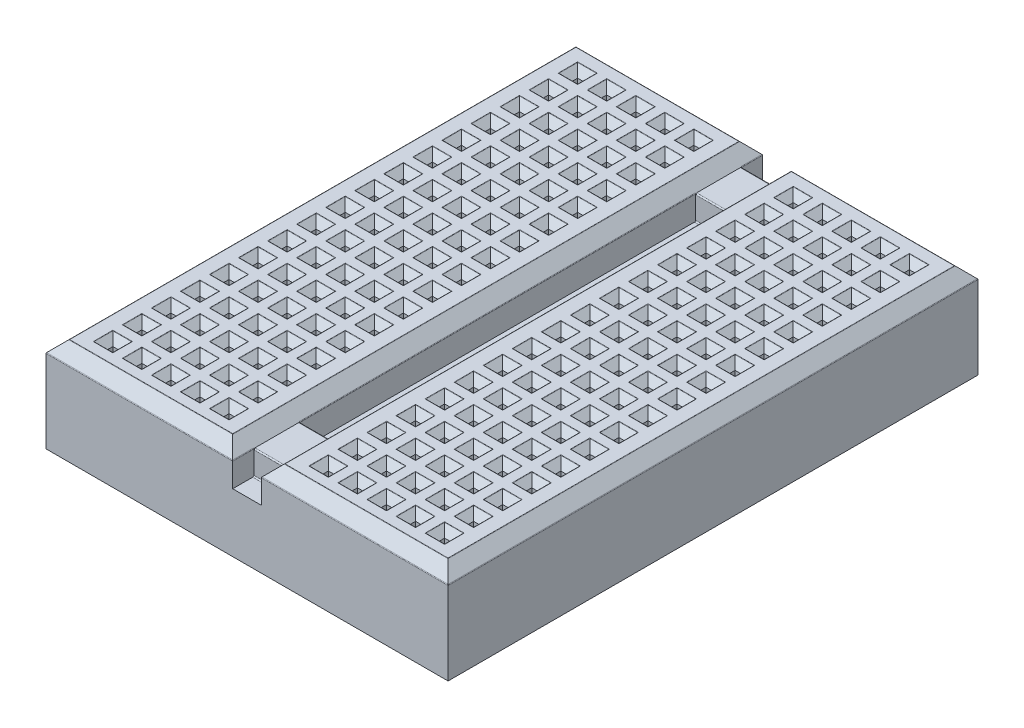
SolidWorks part; units mm, degrees
ref_plane "Front Plane" through (0, 0, 0) normal (0, 0, 1) x (1, 0, 0)
ref_plane "Top Plane" through (0, 0, 0) normal (0, 1, 0) x (1, 0, 0)
ref_plane "Right Plane" through (0, 0, 0) normal (1, 0, 0) x (0, 0, -1)
sketch "Sketch1" plane through (0, 0, 0) normal (0, 1, 0) x (1, 0, 0)
  line L1 (-17.3, 22.8) -> (17.3, 22.8)
  line L2 (-17.3, 22.8) -> (-17.3, -22.8)
  line L3 (-17.3, -22.8) -> (17.3, -22.8)
  line L4 (17.3, 22.8) -> (17.3, -22.8)
  line L5 (-17.3, 22.8) -> (17.3, -22.8) construction
  line L6 (-17.3, -22.8) -> (17.3, 22.8) construction
  point P0 (0, 0)
  dimension "D1" = 34.6
  dimension "D2" = 45.6
extrude "Boss-Extrude1" add sketch "Sketch1" along normal blind 8.15
sketch "Sketch2" plane through (0, 8.15, 0) normal (0, 1, 0) x (1, 0, 0)
  line L0 (0, 22.8) -> (0, -22.8) construction
  line L1 (17.3, 22.8) -> (-17.3, 22.8) construction
  line L2 (-17.3, -22.8) -> (17.3, -22.8) construction
  line L4 (-1.235, -22.8) -> (1.235, -22.8)
  line L5 (-1.235, -22.8) -> (-1.235, 22.8)
  line L6 (-1.235, 22.8) -> (1.235, 22.8)
  line L7 (1.235, -22.8) -> (1.235, 22.8)
  line L8 (-1.235, -22.8) -> (1.235, 22.8) construction
  line L9 (-1.235, 22.8) -> (1.235, -22.8) construction
  point P6 (0, 0)
  dimension "D1" = 2.47
extrude "Cut-Extrude1" cut sketch "Sketch2" against normal blind 3.09
chamfer "Chamfer1" distance 1 angle 45 8 edges at (9.2675, 8.15, -22.8) (17.3, 8.15, 0) (9.2675, 8.15, 22.8) (1.235, 8.15, 0) (-9.2675, 8.15, 22.8) (-17.3, 8.15, 0) (-9.2675, 8.15, -22.8) (-1.235, 8.15, 0)
sketch "Sketch3" plane through (0, 5.06, 0) normal (0, 1, 0) x (1, 0, 0)
  line L0 (1.235, -22.8) -> (1.235, 22.8) construction
  line L1 (-1.235, 20.98) -> (1.235, 20.98)
  line L2 (-1.235, 20.98) -> (-1.235, 17.03)
  line L3 (-1.235, 17.03) -> (1.235, 17.03)
  line L4 (1.235, 20.98) -> (1.235, 17.03)
  line L5 (-1.235, 20.98) -> (1.235, 17.03) construction
  line L6 (-1.235, 17.03) -> (1.235, 20.98) construction
  line L7 (-1.235, -22.8) -> (1.235, -22.8) construction
  line L8 (-1.235, -17.03) -> (1.235, -17.03)
  line L9 (-1.235, -17.03) -> (-1.235, -20.98)
  line L10 (-1.235, -20.98) -> (1.235, -20.98)
  line L11 (1.235, -17.03) -> (1.235, -20.98)
  line L12 (-1.235, -17.03) -> (1.235, -20.98) construction
  line L13 (-1.235, -20.98) -> (1.235, -17.03) construction
  line L14 (1.235, 22.8) -> (-1.235, 22.8) construction
  point P0 (0, 19.005)
  point P7 (0, -19.005)
  dimension "D1" = 3.95
  dimension "D2" = 3.95
  dimension "D3" = 1.82
  dimension "D4" = 1.82
extrude "Boss-Extrude2" add sketch "Sketch3" along normal up to vertex
sketch "Sketch4" plane through (0, 8.15, 0) normal (0, 1, 0) x (1, 0, 0)
  line L0 (-1.235, -22.8) -> (-17.3, -22.8) construction
  line L1 (-14.5, -19.85) -> (-14.05, -19.85)
  line L2 (-14.5, -19.85) -> (-14.5, -20.3)
  line L3 (-14.5, -20.3) -> (-14.05, -20.3)
  line L4 (-14.05, -19.85) -> (-14.05, -20.3)
  line L5 (-14.5, -19.85) -> (-14.05, -20.3) construction
  line L6 (-14.5, -20.3) -> (-14.05, -19.85) construction
  line L671 (4.5, -19.85) -> (4.5, -20.3)
  line L672 (4.5, -19.85) -> (4.05, -19.85)
  line L673 (4.05, -19.85) -> (4.05, -20.3)
  line L674 (4.5, -20.3) -> (4.05, -20.3)
  point P0 (-14.275, -20.075)
  dimension "D1" = 0.45
  dimension "D3" = 2.5
  dimension "D6" = 17
extrude "Cut-Extrude2" cut sketch "Sketch4" against normal blind 7.09
chamfer "Chamfer2" distance 0.6 angle 45 8 edges at (-14.275, 8.15, 20.3) (-14.05, 8.15, 20.075) (-14.5, 8.15, 20.075) (-14.275, 8.15, 19.85) (4.275, 8.15, 20.3) (4.5, 8.15, 20.075) (4.05, 8.15, 20.075) (4.275, 8.15, 19.85)
pattern_linear "LPattern9" count 17 spacing 2.5 along (0, 0, -1) count 5 spacing 2.5 along (1, 0, 0) of "Chamfer2", "Cut-Extrude2"
fillet "Fillet2" radius 0.05 400 edges at (-9.2675, 8.15, -21.8) (-2.235, 8.15, 0) (-9.2675, 8.15, 21.8) (-16.3, 8.15, 0) (-14.275, 8.15, 19.25) (-15.1, 8.15, 20.075) (-14.275, 8.15, 20.9) (-13.45, 8.15, 20.075) (-11.775, 8.15, 19.25) (-12.6, 8.15, 20.075) (-11.775, 8.15, 20.9) (-10.95, 8.15, 20.075) (-9.275, 8.15, 19.25) (-10.1, 8.15, 20.075) (-9.275, 8.15, 20.9) (-8.45, 8.15, 20.075) (-6.775, 8.15, 19.25) (-7.6, 8.15, 20.075) (-6.775, 8.15, 20.9) (-5.95, 8.15, 20.075) (-4.275, 8.15, 19.25) (-5.1, 8.15, 20.075) (-4.275, 8.15, 20.9) (-3.45, 8.15, 20.075) (-14.275, 8.15, 16.75) (-15.1, 8.15, 17.575) (-14.275, 8.15, 18.4) (-13.45, 8.15, 17.575) (-11.775, 8.15, 16.75) (-12.6, 8.15, 17.575) (-11.775, 8.15, 18.4) (-10.95, 8.15, 17.575) (-9.275, 8.15, 16.75) (-10.1, 8.15, 17.575) (-9.275, 8.15, 18.4) (-8.45, 8.15, 17.575) (-6.775, 8.15, 16.75) (-7.6, 8.15, 17.575) (-6.775, 8.15, 18.4) (-5.95, 8.15, 17.575) (-4.275, 8.15, 16.75) (-5.1, 8.15, 17.575) (-4.275, 8.15, 18.4) (-3.45, 8.15, 17.575) (-14.275, 8.15, 14.25) (-15.1, 8.15, 15.075) (-14.275, 8.15, 15.9) (-13.45, 8.15, 15.075) (-11.775, 8.15, 14.25) (-12.6, 8.15, 15.075) (-11.775, 8.15, 15.9) (-10.95, 8.15, 15.075) (-9.275, 8.15, 14.25) (-10.1, 8.15, 15.075) (-9.275, 8.15, 15.9) (-8.45, 8.15, 15.075) (-6.775, 8.15, 14.25) (-7.6, 8.15, 15.075) (-6.775, 8.15, 15.9) (-5.95, 8.15, 15.075) (-4.275, 8.15, 14.25) (-5.1, 8.15, 15.075) (-4.275, 8.15, 15.9) (-3.45, 8.15, 15.075) (-14.275, 8.15, 11.75) (-15.1, 8.15, 12.575) (-14.275, 8.15, 13.4) (-13.45, 8.15, 12.575) (-11.775, 8.15, 11.75) (-12.6, 8.15, 12.575) (-11.775, 8.15, 13.4) (-10.95, 8.15, 12.575) (-9.275, 8.15, 11.75) (-10.1, 8.15, 12.575) (-9.275, 8.15, 13.4) (-8.45, 8.15, 12.575) (-6.775, 8.15, 11.75) (-7.6, 8.15, 12.575) (-6.775, 8.15, 13.4) (-5.95, 8.15, 12.575) (-4.275, 8.15, 11.75) (-5.1, 8.15, 12.575) (-4.275, 8.15, 13.4) (-3.45, 8.15, 12.575) (-14.275, 8.15, 9.25) (-15.1, 8.15, 10.075) (-14.275, 8.15, 10.9) (-13.45, 8.15, 10.075) (-11.775, 8.15, 9.25) (-12.6, 8.15, 10.075) (-11.775, 8.15, 10.9) (-10.95, 8.15, 10.075) (-9.275, 8.15, 9.25) (-10.1, 8.15, 10.075) (-9.275, 8.15, 10.9) (-8.45, 8.15, 10.075) (-6.775, 8.15, 9.25) (-7.6, 8.15, 10.075) (-6.775, 8.15, 10.9) (-5.95, 8.15, 10.075) (-4.275, 8.15, 9.25) (-5.1, 8.15, 10.075) (-4.275, 8.15, 10.9) (-3.45, 8.15, 10.075) (-14.275, 8.15, 6.75) (-15.1, 8.15, 7.575) (-14.275, 8.15, 8.4) (-13.45, 8.15, 7.575) (-11.775, 8.15, 6.75) (-12.6, 8.15, 7.575) (-11.775, 8.15, 8.4) (-10.95, 8.15, 7.575) (-9.275, 8.15, 6.75) (-10.1, 8.15, 7.575) (-9.275, 8.15, 8.4) (-8.45, 8.15, 7.575) (-6.775, 8.15, 6.75) (-7.6, 8.15, 7.575) (-6.775, 8.15, 8.4) (-5.95, 8.15, 7.575) (-4.275, 8.15, 6.75) (-5.1, 8.15, 7.575) (-4.275, 8.15, 8.4) (-3.45, 8.15, 7.575) (-14.275, 8.15, 4.25) (-15.1, 8.15, 5.075) (-14.275, 8.15, 5.9) (-13.45, 8.15, 5.075) (-11.775, 8.15, 4.25) (-12.6, 8.15, 5.075) (-11.775, 8.15, 5.9) (-10.95, 8.15, 5.075) (-9.275, 8.15, 4.25) (-10.1, 8.15, 5.075) (-9.275, 8.15, 5.9) (-8.45, 8.15, 5.075) (-6.775, 8.15, 4.25) (-7.6, 8.15, 5.075) (-6.775, 8.15, 5.9) (-5.95, 8.15, 5.075) (-4.275, 8.15, 4.25) (-5.1, 8.15, 5.075) (-4.275, 8.15, 5.9) (-3.45, 8.15, 5.075) (-14.275, 8.15, 1.75) (-15.1, 8.15, 2.575) (-14.275, 8.15, 3.4) (-13.45, 8.15, 2.575) (-11.775, 8.15, 1.75) (-12.6, 8.15, 2.575) (-11.775, 8.15, 3.4) (-10.95, 8.15, 2.575) (-9.275, 8.15, 1.75) (-10.1, 8.15, 2.575) (-9.275, 8.15, 3.4) (-8.45, 8.15, 2.575) (-6.775, 8.15, 1.75) (-7.6, 8.15, 2.575) (-6.775, 8.15, 3.4) (-5.95, 8.15, 2.575) (-4.275, 8.15, 1.75) (-5.1, 8.15, 2.575) (-4.275, 8.15, 3.4) (-3.45, 8.15, 2.575) (-14.275, 8.15, -0.75) (-15.1, 8.15, 0.075) (-14.275, 8.15, 0.9) (-13.45, 8.15, 0.075) (-11.775, 8.15, -0.75) (-12.6, 8.15, 0.075) (-11.775, 8.15, 0.9) (-10.95, 8.15, 0.075) (-9.275, 8.15, -0.75) (-10.1, 8.15, 0.075) (-9.275, 8.15, 0.9) (-8.45, 8.15, 0.075) (-6.775, 8.15, -0.75) (-7.6, 8.15, 0.075) (-6.775, 8.15, 0.9) (-5.95, 8.15, 0.075) (-4.275, 8.15, -0.75) (-5.1, 8.15, 0.075) (-4.275, 8.15, 0.9) (-3.45, 8.15, 0.075) (-14.275, 8.15, -3.25) (-15.1, 8.15, -2.425) (-14.275, 8.15, -1.6) (-13.45, 8.15, -2.425) (-11.775, 8.15, -3.25) (-12.6, 8.15, -2.425) (-11.775, 8.15, -1.6) (-10.95, 8.15, -2.425) (-9.275, 8.15, -3.25) (-10.1, 8.15, -2.425) (-9.275, 8.15, -1.6) (-8.45, 8.15, -2.425) (-6.775, 8.15, -3.25) (-7.6, 8.15, -2.425) (-6.775, 8.15, -1.6) (-5.95, 8.15, -2.425) (-4.275, 8.15, -3.25) (-5.1, 8.15, -2.425) (-4.275, 8.15, -1.6) (-3.45, 8.15, -2.425) (-14.275, 8.15, -5.75) (-15.1, 8.15, -4.925) (-14.275, 8.15, -4.1) (-13.45, 8.15, -4.925) (-11.775, 8.15, -5.75) (-12.6, 8.15, -4.925) (-11.775, 8.15, -4.1) (-10.95, 8.15, -4.925) (-9.275, 8.15, -5.75) (-10.1, 8.15, -4.925) (-9.275, 8.15, -4.1) (-8.45, 8.15, -4.925) (-6.775, 8.15, -5.75) (-7.6, 8.15, -4.925) (-6.775, 8.15, -4.1) (-5.95, 8.15, -4.925) (-4.275, 8.15, -5.75) (-5.1, 8.15, -4.925) (-4.275, 8.15, -4.1) (-3.45, 8.15, -4.925) (-14.275, 8.15, -8.25) (-15.1, 8.15, -7.425) (-14.275, 8.15, -6.6) (-13.45, 8.15, -7.425) (-11.775, 8.15, -8.25) (-12.6, 8.15, -7.425) (-11.775, 8.15, -6.6) (-10.95, 8.15, -7.425) (-9.275, 8.15, -8.25) (-10.1, 8.15, -7.425) (-9.275, 8.15, -6.6) (-8.45, 8.15, -7.425) (-6.775, 8.15, -8.25) (-7.6, 8.15, -7.425) (-6.775, 8.15, -6.6) (-5.95, 8.15, -7.425) (-4.275, 8.15, -8.25) (-5.1, 8.15, -7.425) (-4.275, 8.15, -6.6) (-3.45, 8.15, -7.425) (-14.275, 8.15, -10.75) (-15.1, 8.15, -9.925) (-14.275, 8.15, -9.1) (-13.45, 8.15, -9.925) (-11.775, 8.15, -10.75) (-12.6, 8.15, -9.925) (-11.775, 8.15, -9.1) (-10.95, 8.15, -9.925) (-9.275, 8.15, -10.75) (-10.1, 8.15, -9.925) (-9.275, 8.15, -9.1) (-8.45, 8.15, -9.925) (-6.775, 8.15, -10.75) (-7.6, 8.15, -9.925) (-6.775, 8.15, -9.1) (-5.95, 8.15, -9.925) (-4.275, 8.15, -10.75) (-5.1, 8.15, -9.925) (-4.275, 8.15, -9.1) (-3.45, 8.15, -9.925) (-14.275, 8.15, -13.25) (-15.1, 8.15, -12.425) (-14.275, 8.15, -11.6) (-13.45, 8.15, -12.425) (-11.775, 8.15, -13.25) (-12.6, 8.15, -12.425) (-11.775, 8.15, -11.6) (-10.95, 8.15, -12.425) (-9.275, 8.15, -13.25) (-10.1, 8.15, -12.425) (-9.275, 8.15, -11.6) (-8.45, 8.15, -12.425) (-6.775, 8.15, -13.25) (-7.6, 8.15, -12.425) (-6.775, 8.15, -11.6) (-5.95, 8.15, -12.425) (-4.275, 8.15, -13.25) (-5.1, 8.15, -12.425) (-4.275, 8.15, -11.6) (-3.45, 8.15, -12.425) (-14.275, 8.15, -15.75) (-15.1, 8.15, -14.925) (-14.275, 8.15, -14.1) (-13.45, 8.15, -14.925) (-11.775, 8.15, -15.75) (-12.6, 8.15, -14.925) (-11.775, 8.15, -14.1) (-10.95, 8.15, -14.925) (-9.275, 8.15, -15.75) (-10.1, 8.15, -14.925) (-9.275, 8.15, -14.1) (-8.45, 8.15, -14.925) (-6.775, 8.15, -15.75) (-7.6, 8.15, -14.925) (-6.775, 8.15, -14.1) (-5.95, 8.15, -14.925) (-4.275, 8.15, -15.75) (-5.1, 8.15, -14.925) (-4.275, 8.15, -14.1) (-3.45, 8.15, -14.925) (-14.275, 8.15, -18.25) (-15.1, 8.15, -17.425) (-14.275, 8.15, -16.6) (-13.45, 8.15, -17.425) (-11.775, 8.15, -18.25) (-12.6, 8.15, -17.425) (-11.775, 8.15, -16.6) (-10.95, 8.15, -17.425) (-9.275, 8.15, -18.25) (-10.1, 8.15, -17.425) (-9.275, 8.15, -16.6) (-8.45, 8.15, -17.425) (-6.775, 8.15, -18.25) (-7.6, 8.15, -17.425) (-6.775, 8.15, -16.6) (-5.95, 8.15, -17.425) (-4.275, 8.15, -18.25) (-5.1, 8.15, -17.425) (-4.275, 8.15, -16.6) (-3.45, 8.15, -17.425) (-14.275, 8.15, -20.75) (-15.1, 8.15, -19.925) (-14.275, 8.15, -19.1) (-13.45, 8.15, -19.925) (-11.775, 8.15, -20.75) (-12.6, 8.15, -19.925) (-11.775, 8.15, -19.1) (-10.95, 8.15, -19.925) (-9.275, 8.15, -20.75) (-10.1, 8.15, -19.925) (-9.275, 8.15, -19.1) (-8.45, 8.15, -19.925) (-6.775, 8.15, -20.75) (-7.6, 8.15, -19.925) (-6.775, 8.15, -19.1) (-5.95, 8.15, -19.925) (-4.275, 8.15, -20.75) (-5.1, 8.15, -19.925) (-4.275, 8.15, -19.1) (-3.45, 8.15, -19.925) (9.2675, 8.15, 21.8) (2.235, 8.15, 0) (9.2675, 8.15, -21.8) (16.3, 8.15, 0) (4.275, 8.15, 19.25) (3.45, 8.15, 20.075) (4.275, 8.15, 20.9) (5.1, 8.15, 20.075) (6.775, 8.15, 19.25) (5.95, 8.15, 20.075) (6.775, 8.15, 20.9) (7.6, 8.15, 20.075) (9.275, 8.15, 19.25) (8.45, 8.15, 20.075) (9.275, 8.15, 20.9) (10.1, 8.15, 20.075) (11.775, 8.15, 19.25) (10.95, 8.15, 20.075) (11.775, 8.15, 20.9) (12.6, 8.15, 20.075) (14.275, 8.15, 19.25) (13.45, 8.15, 20.075) (14.275, 8.15, 20.9) (15.1, 8.15, 20.075) (4.275, 8.15, 16.75) (3.45, 8.15, 17.575) (4.275, 8.15, 18.4) (5.1, 8.15, 17.575) (6.775, 8.15, 16.75) (5.95, 8.15, 17.575) (6.775, 8.15, 18.4) (7.6, 8.15, 17.575) (9.275, 8.15, 16.75) (8.45, 8.15, 17.575) (9.275, 8.15, 18.4) (10.1, 8.15, 17.575) (11.775, 8.15, 16.75) (10.95, 8.15, 17.575) (11.775, 8.15, 18.4) (12.6, 8.15, 17.575) (14.275, 8.15, 16.75) (13.45, 8.15, 17.575) (14.275, 8.15, 18.4) (15.1, 8.15, 17.575) (4.275, 8.15, 14.25) (3.45, 8.15, 15.075) (4.275, 8.15, 15.9) (5.1, 8.15, 15.075) (6.775, 8.15, 14.25) (5.95, 8.15, 15.075) (6.775, 8.15, 15.9) (7.6, 8.15, 15.075) (9.275, 8.15, 14.25) (8.45, 8.15, 15.075) (9.275, 8.15, 15.9) (10.1, 8.15, 15.075)
fillet "Fillet3" radius 0.1 12 edges at (-9.2675, 7.15, -22.8) (9.2675, 7.15, -22.8) (-17.3, 7.15, 0) (-9.2675, 7.15, 22.8) (-1.235, 7.15, -21.89) (-1.235, 7.15, 21.89) (-1.235, 7.15, 0) (1.235, 7.15, -21.89) (1.235, 7.15, 0) (1.235, 7.15, 21.89) (9.2675, 7.15, 22.8) (17.3, 7.15, 0)
fillet "Fillet4" radius 0.1 8 edges at (0, 5.06, 20.98) (0, 7.15, 20.98) (0, 7.15, 17.03) (0, 5.06, 17.03) (0, 5.06, -17.03) (0, 7.15, -17.03) (0, 7.15, -20.98) (0, 5.06, -20.98)
